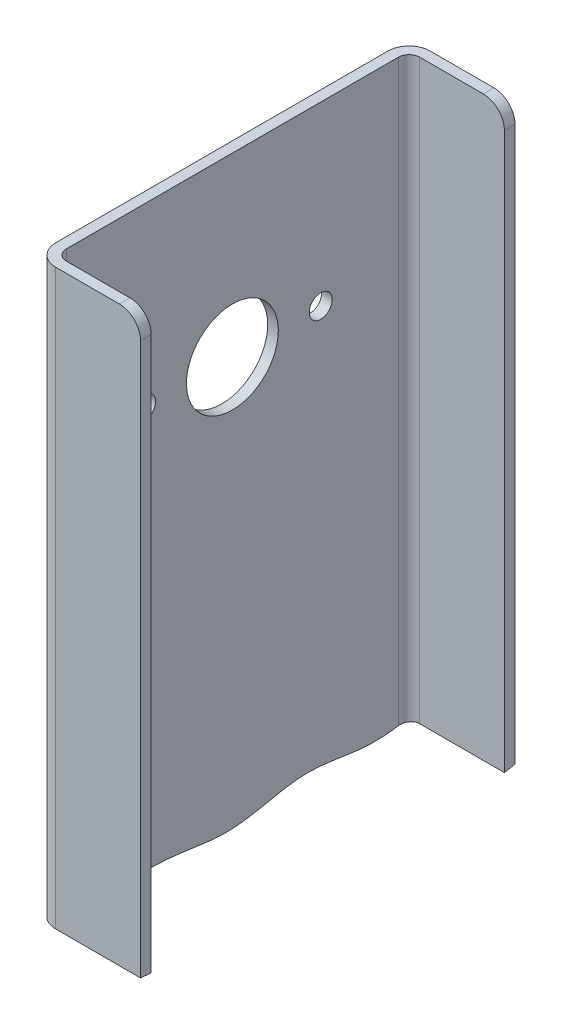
SolidWorks part; units mm, degrees
ref_plane "Plan de face" through (0, 0, 0) normal (0, 0, 1) x (1, 0, 0)
ref_plane "Plan de dessus" through (0, 0, 0) normal (0, 1, 0) x (1, 0, 0)
ref_plane "Plan de droite" through (0, 0, 0) normal (1, 0, 0) x (0, 0, -1)
sketch "Esquisse1" plane through (0, 0, 0) normal (0, 1, 0) x (1, 0, 0)
  line L0 (-173, 53) -> (-203, 53)
  line L1 (-203, 53) -> (-203, -53)
  line L2 (-203, -53) -> (-173, -53)
  line L3 (-173, -53) -> (-173, -50)
  line L4 (-173, -50) -> (-200, -50)
  line L5 (-200, -50) -> (-200, 50)
  line L6 (-200, 50) -> (-173, 50)
  line L7 (-173, 50) -> (-173, 53)
  line L8 (-203, 0) -> (0, 0) construction
  dimension "D1" = 3
  dimension "D2" = 3
  dimension "D3" = 3
  dimension "D4" = 100
  dimension "D5" = 30
  dimension "D6" = 30
  dimension "D7" = 200
extrude "Extrusion1" add sketch "Esquisse1" along normal blind 50 and the other way blind 120
fillet "Congé1" radius 3 2 edges at (-200, -35, -50) (-200, -35, 50)
fillet "Congé2" radius 6 4 edges at (-173, 50, -51.5) (-173, 50, 51.5) (-203, -35, -53) (-203, -35, 53)
sketch "Esquisse2" plane through (-200, 0, 0) normal (1, 0, 0) x (0, 0, -1)
  circle A0 centre (0, 0) radius 13
  dimension "D1" = 26
extrude "Enlèv. mat.-Extru.1" cut sketch "Esquisse2" against normal blind 60
sketch "Esquisse3" plane through (-200, 0, 0) normal (1, 0, 0) x (0, 0, -1)
  line L0 (-25, 0) -> (25, 0) construction
  circle A0 centre (25, 0) radius 3.25
  circle A1 centre (-25, 0) radius 3.25
  dimension "D1" = 6.5
  dimension "D2" = 6.5
  dimension "D3" = 25
  dimension "D4" = 25
extrude "Enlèv. mat.-Extru.2" cut sketch "Esquisse3" against normal blind 60
sketch "Esquisse4" plane through (-203, 0, 0) normal (-1, 0, 0) x (0, 0, 1)
  spline S0 degree 3 poles (-104.3396, -107.9667) (-64.2305, -108.3205) (-45.5044, -117.7643) (-19.7353, -110.4557) (-0.5275, -117.7728) (18.8777, -112.706) (39.9515, -115.0704) (80.2183, -104.2607) (99.5281, -217.8199) (-17.9744, -203.054) (-104.3396, -107.9667) (-64.2305, -108.3205) (-45.5044, -117.7643) knots -0.490308 -0.192956 -0.00914 0 0.094159 0.138569 0.190917 0.239875 0.282527 0.35109 0.509692 0.807044 0.99086 1 1.094159 1.138569 1.190917 only from (-76.1179, -108.2664) to (-76.1179, -108.2664)
extrude "Enlèv. mat.-Extru.3" cut sketch "Esquisse4" against normal blind 60
